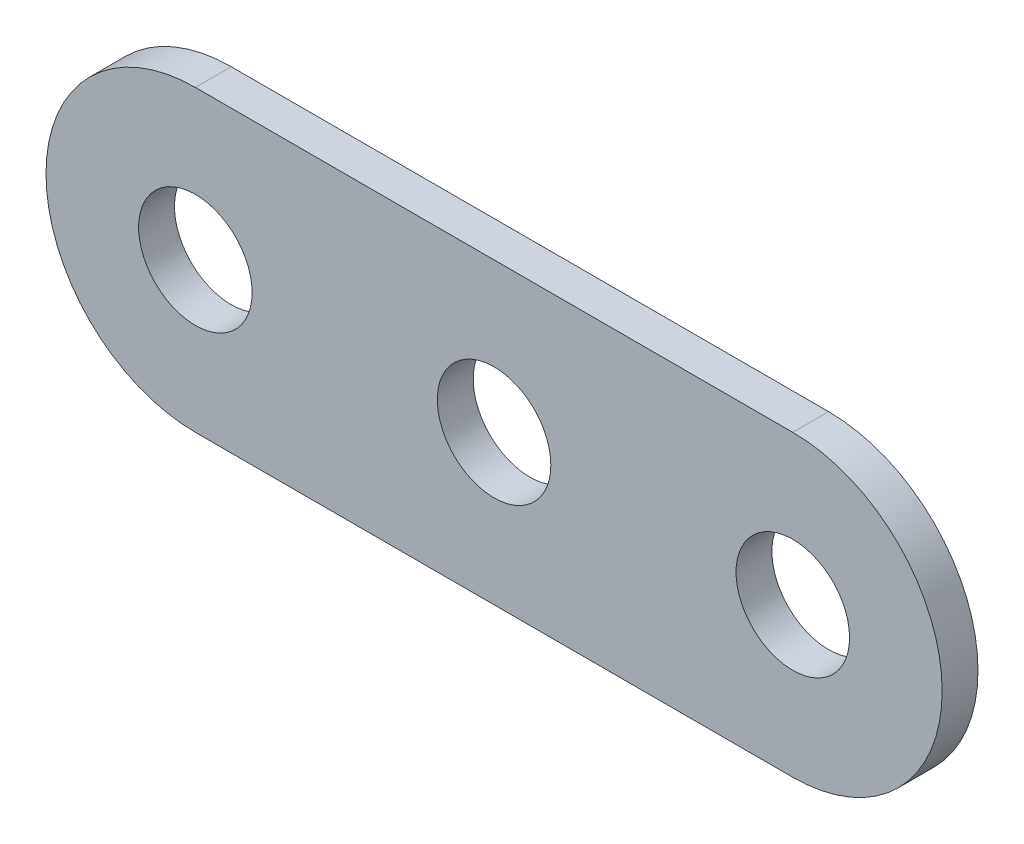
SolidWorks part; units mm, degrees
ref_plane "Front Plane" through (0, 0, 0) normal (0, 0, 1) x (1, 0, 0)
ref_plane "Top Plane" through (0, 0, 0) normal (0, 1, 0) x (1, 0, 0)
ref_plane "Right Plane" through (0, 0, 0) normal (1, 0, 0) x (0, 0, -1)
other "Configuration Table"
sketch "Sketch1" plane through (0, 0, 0) normal (0, 0, 1) x (1, 0, 0)
  line L0 (-12.7, 0) -> (12.7, 0) construction
  line L1 (-12.7, -6.35) -> (12.7, -6.35)
  line L3 (-12.7, 6.35) -> (12.7, 6.35)
  arc A0 (12.7, 6.35) -> (12.7, -6.35) centre (12.7, 0) cw
  arc A1 (-12.7, 6.35) -> (-12.7, -6.35) centre (-12.7, 0) ccw
  dimension "D2" = 6.35
  dimension "D1" = 25.4
extrude "Boss-Extrude1" add sketch "Sketch1" along normal blind 1.524
sketch "Sketch2" plane through (0, 0, 1.524) normal (0, 0, 1) x (1, 0, 0)
  circle A0 centre (-12.7, 0) radius 2.413
  dimension "D1" = 4.826
extrude "Cut-Extrude1" cut sketch "Sketch2" against normal through all
pattern_linear "LPattern1" count 3 spacing 12.7 along (1, 0, 0) of "Cut-Extrude1"
